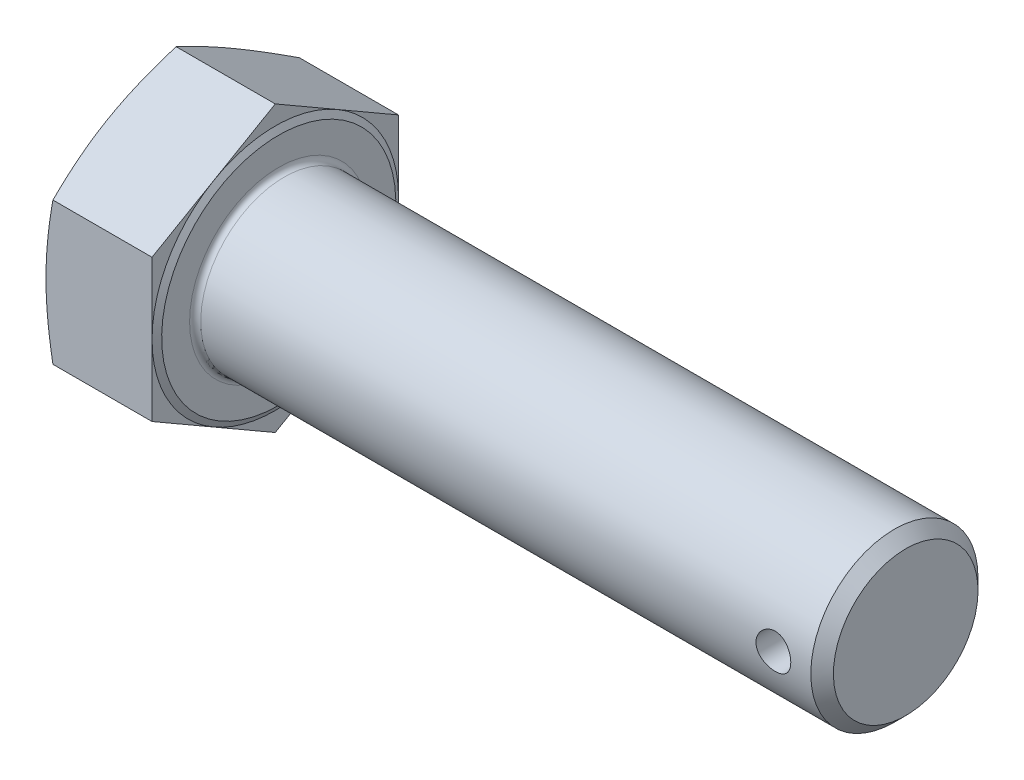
SolidWorks part; units mm, degrees
ref_plane "Front" through (0, 0, 0) normal (0, 0, 1) x (1, 0, 0)
ref_plane "Top" through (0, 0, 0) normal (0, 1, 0) x (1, 0, 0)
ref_plane "Right" through (0, 0, 0) normal (1, 0, 0) x (0, 0, -1)
sketch "Sketch-BaseHead" plane through (0, 0, 0) normal (1, 0, 0) x (0, 0, -1)
  line L1 (0, -20.4267) -> (17.69, -10.2133)
  line L2 (17.69, -10.2133) -> (17.69, 10.2133)
  line L3 (17.69, 10.2133) -> (0, 20.4267)
  line L4 (0, 20.4267) -> (-17.69, 10.2133)
  line L5 (-17.69, 10.2133) -> (-17.69, -10.2133)
  line L6 (-17.69, -10.2133) -> (0, -20.4267)
  circle A0 centre (0, 0) radius 17.69 construction
  dimension "s" = 35.38
extrude "BaseHead" add sketch "Sketch-BaseHead" along normal blind 15.22
sketch "Sketch4" plane through (-0.2646, -5.9169, 0) normal (0, 0, 1) x (0, 1, 0)
  line L0 (5.9169, 3.7369) -> (5.9169, -10.4477) construction
  line L2 (26.3435, -0.2646) -> (23.6069, -0.2646)
  line L4 (23.6069, -0.2646) -> (26.3435, -1.2607)
  line L6 (26.3435, -1.2607) -> (26.3435, -0.2646)
  dimension "D1" = 20
  dimension "D2" = 35.38
revolve "HeadChamfer" cut sketch "Sketch4" angle 360 about L0
sketch "Sketch1" plane through (0, 0, 0) normal (0, 1, 0) x (1, 0, 0)
  line L0 (15.22, 0) -> (15.72, 0)
  line L1 (15.72, 0) -> (15.72, 16.805)
  line L2 (15.72, 16.805) -> (15.22, 17.69)
  line L3 (15.22, 17.69) -> (15.22, 0)
  line L6 (-4.0016, 0) -> (10.1831, 0) construction
  dimension "D1" = 17.69
  dimension "D2" = 16.805
  dimension "D3" = 0.5
revolve "Revolve1" add sketch "Sketch1" angle 360 about axis through (-4.0016, 0, 0) along (1, 0, 0)
ref_plane "Plane2" through (51.72, 0, 0) normal (1, 0, 0) x (0, 0, -1)
sketch "Sketch3" plane through (15.72, 0, 0) normal (1, 0, 0) x (0, 0, -1)
  circle A0 centre (0, 0) radius 12
  dimension "d" = 24
extrude "BaseBody" add sketch "Sketch3" along normal blind 90
chamfer "Chamfer1" distance 1.624 angle 45 1 edges at (105.72, 12, 0)
fillet "HeadFillet" radius 0.8 1 edges at (15.72, -12, 0)
sketch "Sketch5" plane through (0, 0, 0) normal (0, 0, 1) x (1, 0, 0)
  line L2 (15.72, -16.805) -> (15.72, 16.805) construction
  line L3 (104.096, 0) -> (16.52, 0) construction
  circle A0 centre (98.72, 0) radius 2.5
  dimension "d1" = 5
  dimension "lh" = 83
extrude "Hole" cut sketch "Sketch5" against normal through all and the other way through all
equation "\"D1@Sketch1\" = \"s@Sketch-BaseHead\" / 2"
equation "\"D2@Sketch4\" = \"s@Sketch-BaseHead\""
equation "\"D1@Chamfer1\" = (  \"d@Sketch3\"  -\"D2@ThreadCosmetic1\" ) / 2 "
equation "\"b@ThreadCosmetic1\" = \"l@BaseBody\" - \"lg@Plane2\""
